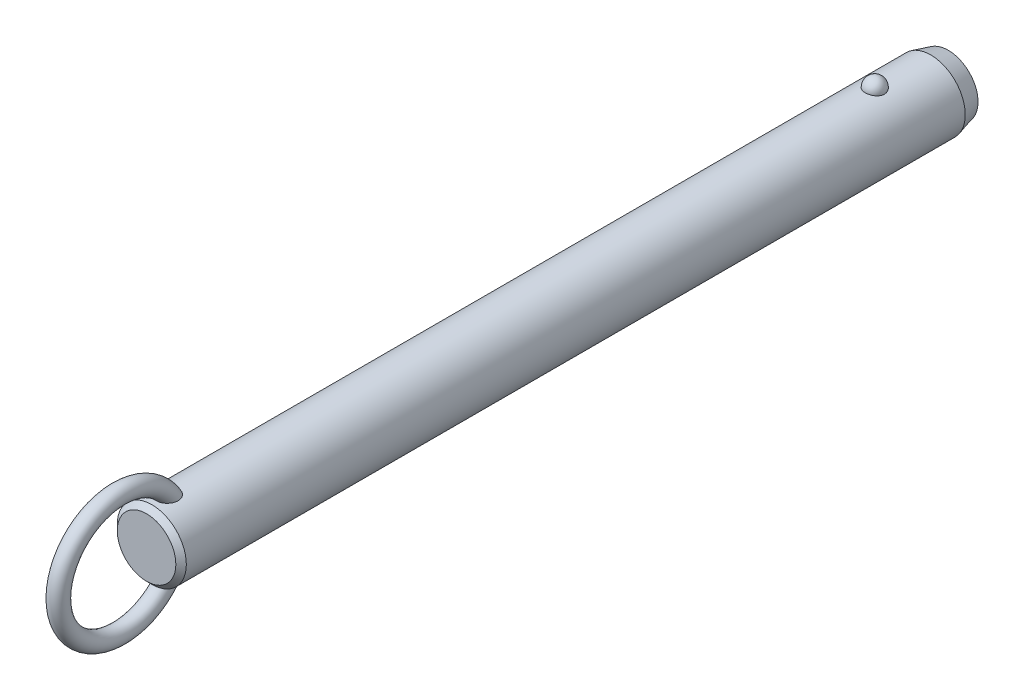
SolidWorks part; units mm, degrees
ref_plane "Front Plane" through (0, 0, 0) normal (0, 0, 1) x (1, 0, 0)
ref_plane "Top Plane" through (0, 0, 0) normal (0, 1, 0) x (1, 0, 0)
ref_plane "Right Plane" through (0, 0, 0) normal (1, 0, 0) x (0, 0, -1)
sketch "Sketch2" plane through (0, 0, 0) normal (0, 0, 1) x (1, 0, 0)
  circle A0 centre (0, 0) radius 7.9
  point P3 (0, 7.9)
  dimension "D1" = 15.8
extrude "Boss-Extrude1" add sketch "Sketch2" along normal blind 154.9
sketch "Sketch3" plane through (0, 0, 0) normal (0, 0, -1) x (-1, 0, 0)
  circle A0 centre (0, 0) radius 7.9
  dimension "D1" = 15.8
extrude "Boss-Extrude2" add sketch "Sketch3" along normal blind 19
chamfer "Chamfer1" distance 4 angle 15 1 edges at (-7.9, 0, -19)
sketch "Sketch12" plane through (0, 0, 0) normal (1, 0, 0) x (0, 0, -1)
  line L0 (-154.9, 7.9) -> (-154.9, -7.9) construction
  point P0 (-154.9, 0)
sketch "Sketch13" plane through (0, 0, 0) normal (1, 0, 0) x (0, 0, -1)
  circle A0 centre (-170.75, 0) radius 15.85
  point P2 (-154.9, 0)
  dimension "D1" = 31.7
sketch "Sketch14" plane through (0, 0, 0) normal (0, 1, 0) x (1, 0, 0)
  circle A0 centre (0, -156.9) radius 2
  point P2 (0, -154.9)
  dimension "D1" = 4
sweep "Sweep1" add profiles "Sketch14" path "Sketch13"
sketch "Sketch15" plane through (0, 0, 154.9) normal (0, 0, 1) x (1, 0, 0)
  circle A0 centre (0, 0) radius 7.9
  dimension "D1" = 15.8
extrude "Boss-Extrude3" add sketch "Sketch15" along normal blind 9.52
chamfer "Chamfer2" distance 1.2 angle 45 1 edges at (7.9, 0, 164.42)
sketch "Sketch18" plane through (0, 0, 0) normal (1, 0, 0) x (0, 0, -1)
  line L0 (15, 7.9) -> (-157.0091, 7.9) construction
  line L1 (2.2, 10.1) -> (2.2, 5.7)
  line L2 (-157.0091, -7.9) -> (15, -7.9) construction
  arc A0 (2.2, 10.1) -> (2.2, 5.7) centre (2.2, 7.9) ccw
  point P4 (0, 7.9)
  dimension "D1" = 18
revolve "Revolve1" add sketch "Sketch18" angle 360 about L1
